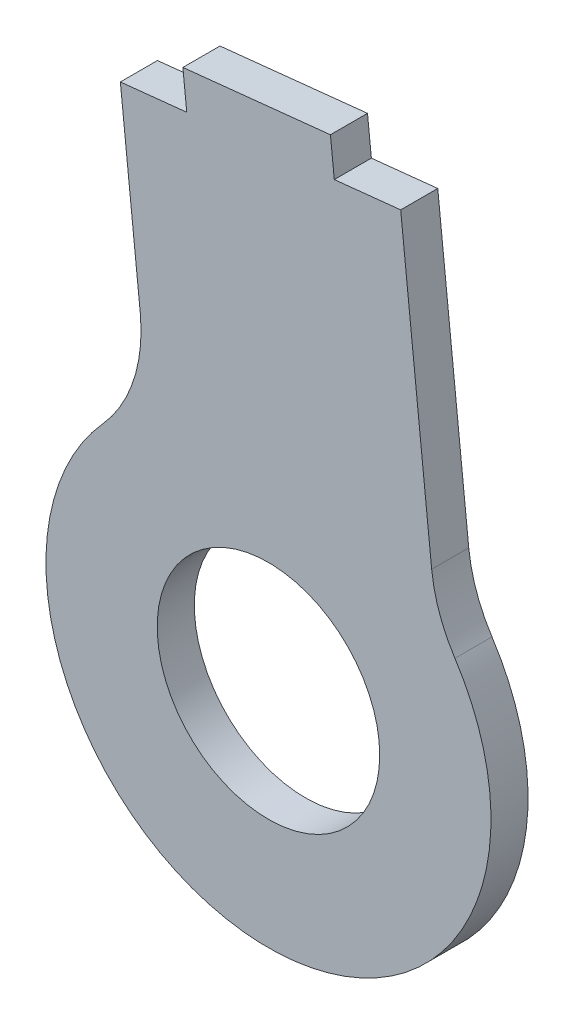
SolidWorks part; units mm, degrees
ref_plane "Front Plane" through (0, 0, 0) normal (0, 0, 1) x (1, 0, 0)
ref_plane "Top Plane" through (0, 0, 0) normal (0, 1, 0) x (1, 0, 0)
ref_plane "Right Plane" through (0, 0, 0) normal (1, 0, 0) x (0, 0, -1)
sketch "Sketch1" plane through (0, 0, 0) normal (0, 0, 1) x (1, 0, 0)
  line L0 (26.1766, 34.5553) -> (26.4372, 32.0689) construction
  line L1 (16.4917, 31.0267) -> (16.2311, 33.513) construction
  line L2 (12.0162, 30.5576) -> (16.4917, 31.0267) construction
  line L3 (16.2311, 33.513) -> (26.1766, 34.5553) construction
  line L4 (26.4372, 32.0689) -> (30.9127, 32.5379) construction
  line L5 (13.3573, 17.7599) -> (12.0162, 30.5576) construction
  line L6 (30.9127, 32.5379) -> (33.0017, 12.6037) construction
  line L7 (26.1766, 34.5553) -> (26.4372, 32.0689)
  line L8 (16.4917, 31.0267) -> (16.2311, 33.513)
  line L9 (12.0162, 30.5576) -> (16.4917, 31.0267)
  line L10 (16.2311, 33.513) -> (26.1766, 34.5553)
  line L11 (26.4372, 32.0689) -> (30.9127, 32.5379)
  line L12 (13.3573, 17.7599) -> (12.0162, 30.5576)
  line L13 (30.9127, 32.5379) -> (33.0017, 12.6037)
  arc A0 (10.8471, 10.0306) -> (34.5684, 8.1876) centre (22, 0) ccw
  circle A1 centre (22, 0) radius 7.5
  arc A2 (33.0017, 12.6037) -> (34.5684, 8.1876) centre (42.9473, 13.6459) ccw construction
  arc A3 (10.8471, 10.0306) -> (13.3573, 17.7599) centre (3.4118, 16.7176) ccw construction
  arc A4 (33.0017, 12.6037) -> (34.5684, 8.1876) centre (42.9473, 13.6459) ccw
  arc A5 (10.8471, 10.0306) -> (13.3573, 17.7599) centre (3.4118, 16.7176) ccw
extrude "Boss-Extrude1" add sketch "Sketch1" along normal blind 2.5
